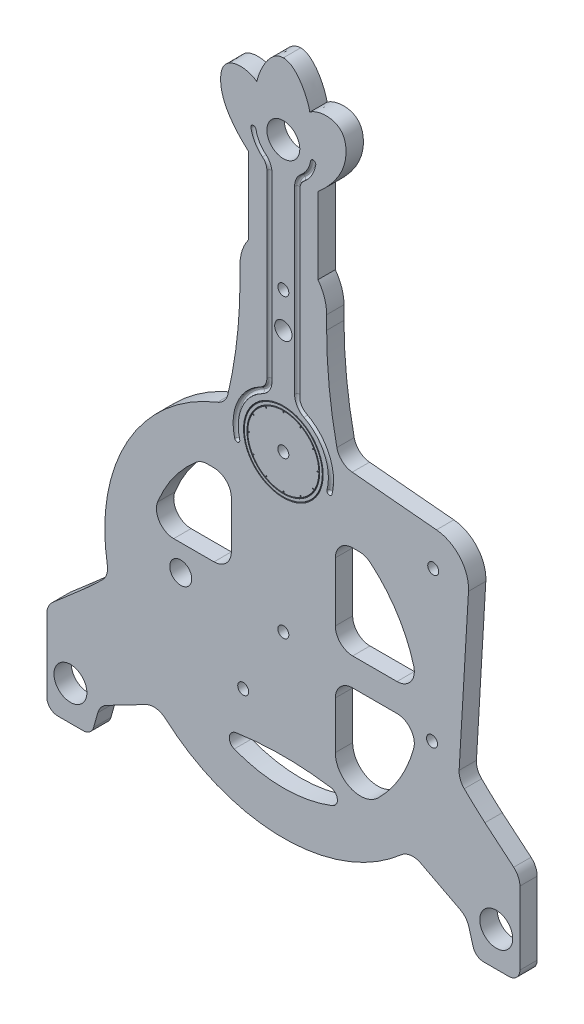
SolidWorks part; units mm, degrees
ref_plane "Спереди" through (0, 0, 0) normal (0, 0, 1) x (1, 0, 0)
ref_plane "Сверху" through (0, 0, 0) normal (0, 1, 0) x (1, 0, 0)
ref_plane "Справа" through (0, 0, 0) normal (1, 0, 0) x (0, 0, -1)
sketch "Эскиз1" plane through (0, 0, 0) normal (0, 0, 1) x (1, 0, 0)
  line L0 (-122.85, -87.13) -> (0, -87.13) construction
  line L1 (0, -87.13) -> (122.85, -87.13) construction
  line L2 (-130.15, -107.13) -> (-115.6025, -107.13)
  line L3 (115.6025, -107.13) -> (130.15, -107.13)
  line L4 (-136.5, -100.78) -> (-136.5, -59.2917)
  line L5 (136.5, -100.78) -> (136.5, -58.7923)
  line L6 (-136.5, -67.675) -> (0, -67.675) construction
  line L7 (0, -67.675) -> (136.5, -67.675) construction
  line L8 (-109.4924, -102.509) -> (-107.0546, -93.8939)
  line L9 (0, 423.5848) -> (0, -143.4551) construction
  line L10 (109.4924, -102.509) -> (107.0546, -93.8939)
  line L11 (-102.0344, -87.7385) -> (-79.3025, -75.9555)
  line L12 (102.0344, -87.7385) -> (79.3025, -75.9555)
  line L13 (-133.0606, -51.7446) -> (-116.3266, -37.198)
  line L14 (132.9289, -51.1327) -> (116.3266, -37.198)
  line L15 (-30, 52) -> (-30, 25)
  line L16 (-40, 15) -> (-63.243, 15)
  line L17 (-43.8256, 62) -> (-40, 62)
  line L18 (30, 52) -> (30, 18)
  line L19 (40, 62) -> (43.8256, 62)
  line L20 (40, 8) -> (65.5796, 8)
  line L21 (40, -8) -> (65.5796, -8)
  line L22 (30, -18) -> (30, -45.306)
  line L23 (101.4329, -18.4609) -> (106.8371, 73.7083)
  line L24 (39.7477, 99.705) -> (88.3745, 95.1941)
  line L25 (-13.1102, 246) -> (23.4638, 246) construction
  line L26 (-87.3301, 163.2) -> (639.8993, 163.2) construction
  line L27 (25, 216.6699) -> (25, 129.11) construction
  line L28 (25, 171) -> (25, 163.2)
  line L29 (-25, 171) -> (-25, 163.2)
  line L30 (20, 230.002) -> (20, 186)
  line L31 (-26.7, -59.2917) -> (-26.7, -78.9796) construction
  line L32 (-63.243, 286.87) -> (65.5796, 286.87) construction
  line L33 (1.1783, 286.87) -> (-1.2329, 286.87) construction
  line L34 (0, 286.87) -> (15.24, 286.87) construction
  line L35 (0, 286.87) -> (0, 267.326) construction
  line L36 (0, 267.326) -> (15.24, 267.326) construction
  line L37 (15.24, 286.87) -> (15.24, 267.326) construction
  line L38 (33.02, 280.1269) -> (33.02, 264.4046) construction
  line L39 (15.24, 230.002) -> (36.186, 230.002) construction
  line L40 (36.186, 276.4457) -> (36.186, 250.5137) construction
  line L41 (15.24, 267.326) -> (40.6715, 267.326) construction
  line L42 (-20, 230.002) -> (-20, 186)
  line L43 (26.7, -59.2917) -> (26.7, -78.9796) construction
  line L44 (26.7, -78.9796) -> (0, -78.9796) construction
  line L45 (0, -78.9796) -> (-26.7, -78.9796) construction
  line L46 (0, -78.005) -> (0, -62.005) construction
  arc A0 (-68.0919, -77.3285) -> (68.0919, -77.3285) centre (0, 0) ccw
  circle A1 centre (-122.85, -87.13) radius 9.5
  circle A2 centre (122.85, -87.13) radius 9.5
  arc A3 (130.15, -107.13) -> (136.5, -100.78) centre (130.15, -100.78) ccw
  arc A4 (115.6025, -107.13) -> (109.4924, -102.509) centre (115.6025, -100.78) cw
  arc A5 (-109.4924, -102.509) -> (-115.6025, -107.13) centre (-115.6025, -100.78) cw
  arc A6 (-136.5, -100.78) -> (-130.15, -107.13) centre (-130.15, -100.78) ccw
  arc A7 (-31.9641, 102.786) -> (-38.0125, 95.7667) centre (-41.7018, 105.0613) cw
  arc A8 (-102.0344, -87.7385) -> (-107.0546, -93.8939) centre (-97.4324, -96.6167) ccw
  arc A9 (-79.3025, -75.9555) -> (-68.0919, -77.3285) centre (-74.7005, -84.8336) cw
  arc A10 (102.0344, -87.7385) -> (107.0546, -93.8939) centre (97.4324, -96.6167) cw
  arc A11 (79.3025, -75.9555) -> (68.0919, -77.3285) centre (74.7005, -84.8336) ccw
  arc A12 (132.9289, -51.1327) -> (136.5, -58.7923) centre (126.5, -58.7923) cw
  arc A13 (104.4063, -26.1783) -> (101.4329, -18.4609) centre (111.4158, -19.0462) cw
  arc A14 (-101.5614, -17.3635) -> (-104.409, -26.1809) centre (-111.4184, -19.0488) cw
  arc A15 (-133.0606, -51.7446) -> (-136.5, -59.2917) centre (-126.5, -59.2917) ccw
  arc A16 (-20, 186) -> (-25, 171) centre (0, 171) ccw
  arc A18 (-27.3599, -64.0329) -> (-28.3346, -72.6769) centre (-26.7, -68.4843) ccw
  arc A19 (54.6606, -55.6507) -> (75.2229, -20.6469) centre (0, 0) ccw
  arc A20 (-43.8256, 62) -> (-50.27, 59.6465) centre (-43.8256, 52) ccw
  arc A21 (-40, 62) -> (-30, 52) centre (-40, 52) cw
  arc A22 (-30, 25) -> (-40, 15) centre (-40, 25) cw
  arc A23 (-63.243, 15) -> (-72.5428, 28.6762) centre (-63.243, 25) cw
  circle A24 centre (-59.2, 0) radius 6.35
  circle A25 centre (0, 0) radius 3.175
  arc A27 (40, 62) -> (30, 52) centre (40, 52) ccw
  arc A28 (43.8256, 62) -> (50.27, 59.6465) centre (43.8256, 52) cw
  arc A29 (65.5796, 8) -> (75.2229, 20.6469) centre (65.5796, 18) ccw
  arc A30 (30, 18) -> (40, 8) centre (40, 18) ccw
  arc A31 (65.5796, -8) -> (75.2229, -20.6469) centre (65.5796, -18) cw
  arc A32 (40, -8) -> (30, -18) centre (40, -18) ccw
  arc A33 (30, -45.306) -> (54.6606, -55.6507) centre (44.5, -45.306) ccw
  circle A34 centre (-23.15, -39.9815) radius 3.175
  circle A35 centre (0, 90) radius 3.175
  circle A36 centre (86.492, 74.9012) radius 3.175
  circle A37 centre (85.8065, -11.6961) radius 3.175
  arc A38 (106.8371, 73.7083) -> (88.3745, 95.1941) centre (86.492, 74.9012) ccw
  arc A39 (28.3346, -72.6769) -> (27.3599, -64.0329) centre (26.7, -68.4843) ccw
  circle A40 centre (0, 150.61) radius 5
  circle A41 centre (0, 171) radius 3.175
  circle A42 centre (0, 246) radius 9.5
  arc A43 (25, 163.2) -> (30.8934, 107.5671) centre (290.53, 163.2) ccw
  arc A44 (104.4063, -26.1783) -> (116.3266, -37.198) centre (290.53, 163.2) ccw
  arc A45 (25, 171) -> (20, 186) centre (0, 171) ccw
  arc A46 (-104.409, -26.1809) -> (-116.3266, -37.198) centre (-290.53, 163.2) cw
  arc A47 (30.8934, 107.5671) -> (39.7477, 99.705) centre (40.6715, 109.6623) ccw
  arc A48 (-25, 163.2) -> (-31.9641, 102.786) centre (-290.53, 163.2) cw
  arc A49 (-38.0125, 95.7667) -> (-101.5614, -17.3635) centre (0, 0) ccw
  arc A50 (-33.2507, 97.5223) -> (101.4646, -17.9204) centre (0, 0) ccw construction
  arc A51 (-28.3346, -72.6769) -> (28.3346, -72.6769) centre (0, 0) ccw
  arc A52 (75.2229, 20.6469) -> (50.27, 59.6465) centre (0, 0) ccw
  arc A53 (-50.27, 59.6465) -> (-72.5428, 28.6762) centre (0, 0) ccw
  spline S0 degree 3 poles (0, 286.87) (8.942, 286.87) (14.9128, 270.8257) (15.24, 267.326) knots 0 0 0 0 1 1 1 1
  spline S1 degree 3 poles (0, 286.87) (-8.942, 286.87) (-14.9128, 270.8257) (-15.24, 267.326) knots 0 0 0 0 1 1 1 1
  spline S2 degree 3 poles (15.24, 267.326) (19.1959, 270.4735) (28.3245, 271.6833) (35.5232, 265.0967) (38.2516, 249.0583) (27.773, 236.8661) (20, 230.002) knots 0 0 0 0 0.265881 0.312689 0.468082 1 1 1 1
  spline S3 degree 3 poles (-15.24, 267.326) (-19.1959, 270.4735) (-28.3245, 271.6833) (-35.5232, 265.0967) (-38.2516, 249.0583) (-27.773, 236.8661) (-20, 230.002) knots 0 0 0 0 0.265881 0.312689 0.468082 1 1 1 1
  spline S4 degree 2 poles (-27.3599, -64.0329) (0, -59.9771) (27.3599, -64.0329) knots 0 0 0 1 1 1
  point P21 (136.5, -54.13)
  point P25 (110.8, -107.13)
  point P28 (-110.8, -107.13)
  point P31 (-136.5, -107.13)
  point P34 (-105.8763, -89.73)
  point P38 (-105.8763, -89.73)
  point P41 (-73.0162, -72.6969)
  point P44 (105.8763, -89.73)
  point P47 (73.0162, -72.6969)
  point P53 (100.2677, -23.7194)
  point P56 (-100.2677, -23.7194)
  point P59 (-136.5, -54.13)
  point P60 (-136.5, -107.13)
  point P92 (77.5937, 8)
  dimension "D1" = 206.07
  dimension "D2" = 19
  dimension "D9" = 6.35
  dimension "D12" = 10
  dimension "D15" = 10
  dimension "D20" = 10
  dimension "D21" = 12.7
  dimension "D23" = 6.35
  dimension "D27" = 10
  dimension "D28" = 10
  dimension "D29" = 14.5
  dimension "D35" = 40.76
  dimension "D37" = 10
  dimension "D39" = 10
  dimension "D42" = 19
  dimension "D46" = 531.06
  dimension "D13" = 10
  dimension "D48" = 10
  dimension "D16" = 10
  dimension "D49" = 103.035
  dimension "D57" = 156.01
  dimension "D59" = 9
  dimension "D3" = 245.7
  dimension "D4" = 107.13
  dimension "D5" = 20
  dimension "D6" = 273
  dimension "D7" = 15.8
  dimension "D8" = 25.7
  dimension "D10" = 27.4
  dimension "D11" = 17.4
  dimension "D14" = 53
  dimension "D17" = 30
  dimension "D18" = 15
  dimension "D19" = 62
  dimension "D22" = 59.2
  dimension "D24" = 30
  dimension "D25" = 8
  dimension "D26" = 16
  dimension "D30" = 46.2
  dimension "D31" = 23.15
  dimension "D32" = 90
  dimension "D33" = 86.6
  dimension "D34" = 87.8
  dimension "D36" = 86.6
  dimension "D38" = 5.3
  dimension "D40" = 60.61
  dimension "D41" = 81
  dimension "D43" = 156
  dimension "D44" = 86.492
  dimension "D45" = 73.2
  dimension "D47" = 25
  dimension "D50" = 20
  dimension "D51" = 394
  dimension "D52" = 15.24
  dimension "D53" = 19.544
  dimension "D54" = 17.78
  dimension "D55" = 37.324
  dimension "D56" = 36.186
  dimension "D58" = 53.4
  dimension "D60" = 16
extrude "Бобышка-Вытянуть1" add sketch "Эскиз1" along normal blind 10
sketch "Эскиз2" plane through (0, 0, 10) normal (0, 0, 1) x (1, 0, 0)
  line L0 (0, 246) -> (0, 0) construction
  line L1 (-6.5, 225.9065) -> (-6.5, 121.9961)
  line L2 (-9.5, 225.9065) -> (-9.5, 121.9961)
  line L3 (9.5, 225.9065) -> (9.5, 121.9961)
  line L4 (6.5, 225.9065) -> (6.5, 121.9961)
  line L5 (0, 90) -> (-33.1699, 79.4141) construction
  line L6 (-42.1713, 90) -> (46.7662, 90) construction
  line L7 (0, 246) -> (-21.7469, 242.1654) construction
  line L8 (-37.3366, 246) -> (39.1828, 246) construction
  arc A0 (-11.9167, 113.1083) -> (-25.1635, 83.458) centre (0, 90) ccw
  arc A1 (-13.2917, 115.7746) -> (-28.067, 82.7031) centre (0, 90) ccw
  circle A2 centre (0, 90) radius 29 construction
  arc A3 (10.1538, 233.6347) -> (15.7569, 243.2216) centre (0, 246) ccw
  circle A4 centre (0, 90) radius 26 construction
  arc A5 (6.5, 121.9961) -> (11.9167, 113.1083) centre (16.5, 121.9961) ccw
  arc A6 (-6.5, 121.9961) -> (-11.9167, 113.1083) centre (-16.5, 121.9961) cw
  arc A7 (9.5, 121.9961) -> (13.2917, 115.7746) centre (16.5, 121.9961) ccw
  arc A8 (-13.2917, 115.7746) -> (-9.5, 121.9961) centre (-16.5, 121.9961) ccw
  arc A9 (25.1635, 83.458) -> (11.9167, 113.1083) centre (0, 90) ccw
  arc A10 (28.067, 82.7031) -> (13.2917, 115.7746) centre (0, 90) ccw
  arc A11 (-28.067, 82.7031) -> (-25.1635, 83.458) centre (-26.6152, 83.0805) ccw
  arc A12 (25.1635, 83.458) -> (28.067, 82.7031) centre (26.6152, 83.0805) ccw
  arc A13 (12.0577, 231.3163) -> (18.7113, 242.7007) centre (0, 246) ccw
  circle A14 centre (0, 246) radius 16 construction
  circle A15 centre (0, 246) radius 19 construction
  arc A16 (12.0577, 231.3163) -> (9.5, 225.9065) centre (16.5, 225.9065) ccw
  arc A17 (-12.0577, 231.3163) -> (-9.5, 225.9065) centre (-16.5, 225.9065) cw
  arc A18 (6.5, 225.9065) -> (10.1538, 233.6347) centre (16.5, 225.9065) cw
  arc A19 (-6.5, 225.9065) -> (-10.1538, 233.6347) centre (-16.5, 225.9065) ccw
  arc A20 (-15.7569, 243.2216) -> (-18.7113, 242.7007) centre (-17.2341, 242.9612) ccw
  arc A21 (15.7569, 243.2216) -> (18.7113, 242.7007) centre (17.2341, 242.9612) cw
  arc A22 (-18.7113, 242.7007) -> (-12.0577, 231.3163) centre (0, 246) ccw
  arc A23 (-15.7569, 243.2216) -> (-10.1538, 233.6347) centre (0, 246) ccw
  point P19 (6.5, 115.1744)
  point P22 (-6.5, 115.1744)
  point P25 (9.5, 117.3998)
  point P28 (-9.5, 117.3998)
  dimension "D1" = 52
  dimension "D5" = 10
  dimension "D6" = 7
  dimension "D8" = 32
  dimension "D10" = 7
  dimension "D11" = 10
  dimension "D3" = 3
  dimension "D4" = 6.5
  dimension "D7" = 17.7
  dimension "D12" = 10
  dimension "D2" = 3
  dimension "D9" = 3
extrude "Вырез-Вытянуть1" cut sketch "Эскиз2" against normal blind 1.5
fillet "Скругление1" radius 1.5 24 edges at (-13.8137, 237.9265, 8.5) (-7.4595, 230.1807, 8.5) (-6.5, 173.9513, 8.5) (-7.9609, 116.7919, 8.5) (-23.7386, 100.6056, 8.5) (-26.2378, 81.6288, 8.5) (-26.4776, 101.8294, 8.5) (-10.5226, 118.3532, 8.5) (-9.5, 173.9513, 8.5) (-10.1716, 228.8984, 8.5) (-16.4038, 236.4128, 8.5) (16.4038, 236.4128, 8.5) (10.1716, 228.8984, 8.5) (9.5, 173.9513, 8.5) (10.5226, 118.3532, 8.5) (26.4776, 101.8294, 8.5) (26.2378, 81.6288, 8.5) (23.7386, 100.6056, 8.5) (7.9609, 116.7919, 8.5) (6.5, 173.9513, 8.5) (7.4595, 230.1807, 8.5) (13.8137, 237.9265, 8.5) (-17.4946, 244.4384, 8.5) (17.4946, 244.4384, 8.5)
sketch "Эскиз3" plane through (0, 0, 10) normal (0, 0, 1) x (1, 0, 0)
  line L0 (0, 118.0281) -> (0, 90) construction
  line L1 (-0.25, 110.4985) -> (-0.25, 109.4985)
  line L2 (-0.25, 109.4985) -> (0.25, 109.4985)
  line L3 (0.25, 109.4985) -> (0.25, 110.4985)
  line L4 (10.0327, 107.8772) -> (9.5327, 107.0112)
  line L5 (9.5327, 107.0112) -> (9.9657, 106.7612)
  line L6 (9.9657, 106.7612) -> (10.4657, 107.6272)
  line L7 (17.6272, 100.4657) -> (16.7612, 99.9657)
  line L8 (16.7612, 99.9657) -> (17.0112, 99.5327)
  line L9 (17.0112, 99.5327) -> (17.8772, 100.0327)
  line L10 (20.4985, 90.25) -> (19.4985, 90.25)
  line L11 (19.4985, 90.25) -> (19.4985, 89.75)
  line L12 (19.4985, 89.75) -> (20.4985, 89.75)
  line L13 (17.8772, 79.9673) -> (17.0112, 80.4673)
  line L14 (17.0112, 80.4673) -> (16.7612, 80.0343)
  line L15 (16.7612, 80.0343) -> (17.6272, 79.5343)
  line L16 (10.4657, 72.3728) -> (9.9657, 73.2388)
  line L17 (9.9657, 73.2388) -> (9.5327, 72.9888)
  line L18 (9.5327, 72.9888) -> (10.0327, 72.1228)
  line L19 (0.25, 69.5015) -> (0.25, 70.5015)
  line L20 (0.25, 70.5015) -> (-0.25, 70.5015)
  line L21 (-0.25, 70.5015) -> (-0.25, 69.5015)
  line L22 (-10.0327, 72.1228) -> (-9.5327, 72.9888)
  line L23 (-9.5327, 72.9888) -> (-9.9657, 73.2388)
  line L24 (-9.9657, 73.2388) -> (-10.4657, 72.3728)
  line L25 (-17.6272, 79.5343) -> (-16.7612, 80.0343)
  line L26 (-16.7612, 80.0343) -> (-17.0112, 80.4673)
  line L27 (-17.0112, 80.4673) -> (-17.8772, 79.9673)
  line L28 (-20.4985, 89.75) -> (-19.4985, 89.75)
  line L29 (-19.4985, 89.75) -> (-19.4985, 90.25)
  line L30 (-19.4985, 90.25) -> (-20.4985, 90.25)
  line L31 (-17.8772, 100.0327) -> (-17.0112, 99.5327)
  line L32 (-17.0112, 99.5327) -> (-16.7612, 99.9657)
  line L33 (-16.7612, 99.9657) -> (-17.6272, 100.4657)
  line L34 (-10.4657, 107.6272) -> (-9.9657, 106.7612)
  line L35 (-9.9657, 106.7612) -> (-9.5327, 107.0112)
  line L36 (-9.5327, 107.0112) -> (-10.0327, 107.8772)
  circle A0 centre (0, 90) radius 23
  arc A1 (-0.25, 110.4985) -> (-10.0327, 107.8772) centre (0, 90) ccw
  circle A2 centre (0, 90) radius 21
  circle A3 centre (0, 90) radius 22.5
  circle A4 centre (0, 90) radius 20.5 construction
  arc A5 (10.0327, 107.8772) -> (0.25, 110.4985) centre (0, 90) ccw
  arc A6 (-10.4657, 107.6272) -> (-17.6272, 100.4657) centre (0, 90) ccw
  arc A7 (-17.8772, 100.0327) -> (-20.4985, 90.25) centre (0, 90) ccw
  arc A8 (-20.4985, 89.75) -> (-17.8772, 79.9673) centre (0, 90) ccw
  arc A9 (-17.6272, 79.5343) -> (-10.4657, 72.3728) centre (0, 90) ccw
  arc A10 (-10.0327, 72.1228) -> (-0.25, 69.5015) centre (0, 90) ccw
  arc A11 (0.25, 69.5015) -> (10.0327, 72.1228) centre (0, 90) ccw
  arc A12 (10.4657, 72.3728) -> (17.6272, 79.5343) centre (0, 90) ccw
  arc A13 (17.8772, 79.9673) -> (20.4985, 89.75) centre (0, 90) ccw
  arc A14 (20.4985, 90.25) -> (17.8772, 100.0327) centre (0, 90) ccw
  arc A15 (17.6272, 100.4657) -> (10.4657, 107.6272) centre (0, 90) ccw
  point P12 (0, 109.4985)
  point P20 (9.7492, 106.8862)
  point P25 (16.8862, 99.7492)
  point P30 (19.4985, 90)
  point P35 (16.8862, 80.2508)
  point P40 (9.7492, 73.1138)
  point P45 (0, 70.5015)
  point P50 (-9.7492, 73.1138)
  point P55 (-16.8862, 80.2508)
  point P60 (-19.4985, 90)
  point P65 (-16.8862, 99.7492)
  point P70 (-9.7492, 106.8862)
  dimension "D1" = 46
  dimension "D5" = 1
  dimension "D6" = 0.5
  dimension "D2" = 2.5
  dimension "D3" = 0.5
  dimension "D4" = 0.5
  dimension "D7" = 12
extrude "Вырез-Вытянуть2" cut sketch "Эскиз3" against normal blind 0.5 contours A0 | A3 | A6 L33 L32 L31 A7 L30 L29 L28 A8 L27 L26 L25 A9 L24 L23 L22 A10 L21 L20 L19 A11 L18 L17 L16 A12 L15 L14 L13 A13 L12 L11 L10 A14 L9 L8 L7 A15 L6 L5 L4 A5 L3 L2 L1 A1 L36 L35 L34 | A2
chamfer "Фаска1" distance 0.25 angle 45 51 edges at (23, 90, 9.5) (22.5, 90, 9.5) (21, 90, 9.5) (-14.4957, 104.4957, 9.5) (-17.1942, 100.2157, 9.5) (-16.8862, 99.7492, 9.5) (-17.4442, 99.7827, 9.5) (-19.8015, 95.3058, 9.5) (-19.9985, 90.25, 9.5) (-19.4985, 90, 9.5) (-19.9985, 89.75, 9.5) (-19.8015, 84.6942, 9.5) (-17.4442, 80.2173, 9.5) (-16.8862, 80.2508, 9.5) (-17.1942, 79.7843, 9.5) (-14.4957, 75.5043, 9.5) (-10.2157, 72.8058, 9.5) (-9.7492, 73.1138, 9.5) (-9.7827, 72.5558, 9.5) (-5.3058, 70.1985, 9.5) (-0.25, 70.0015, 9.5) (0, 70.5015, 9.5) (0.25, 70.0015, 9.5) (5.3058, 70.1985, 9.5) (9.7827, 72.5558, 9.5) (9.7492, 73.1138, 9.5) (10.2157, 72.8058, 9.5) (14.4957, 75.5043, 9.5) (17.1942, 79.7843, 9.5) (16.8862, 80.2508, 9.5) (17.4442, 80.2173, 9.5) (19.8015, 84.6942, 9.5) (19.9985, 89.75, 9.5) (19.4985, 90, 9.5) (19.9985, 90.25, 9.5) (19.8015, 95.3058, 9.5) (17.4442, 99.7827, 9.5) (16.8862, 99.7492, 9.5) (17.1942, 100.2157, 9.5) (14.4957, 104.4957, 9.5) (10.2157, 107.1942, 9.5) (9.7492, 106.8862, 9.5) (9.7827, 107.4442, 9.5) (5.3058, 109.8015, 9.5) (0.25, 109.9985, 9.5) (0, 109.4985, 9.5) (-0.25, 109.9985, 9.5) (-5.3058, 109.8015, 9.5) (-9.7827, 107.4442, 9.5) (-9.7492, 106.8862, 9.5) (-10.2157, 107.1942, 9.5)
